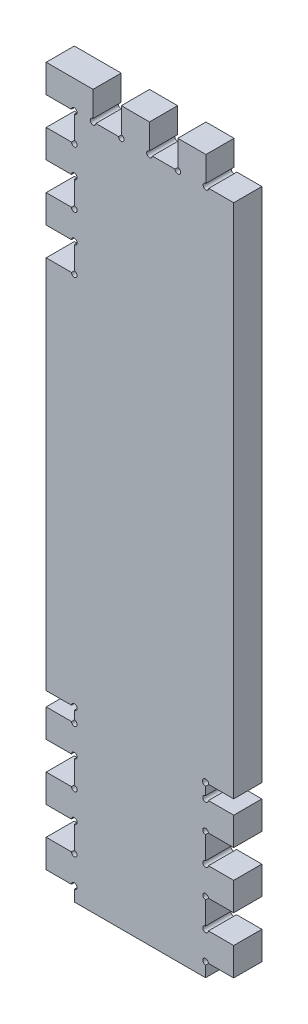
SolidWorks part; units mm, degrees
ref_plane "Ebene vorne" through (0, 0, 0) normal (0, 0, 1) x (1, 0, 0)
ref_plane "Ebene oben" through (0, 0, 0) normal (0, 1, 0) x (1, 0, 0)
ref_plane "Ebene rechts" through (0, 0, 0) normal (1, 0, 0) x (0, 0, -1)
sketch "Skizze1" plane through (0, 0, 0) normal (0, 0, 1) x (1, 0, 0)
  line L0 (0, 82.6) -> (13.5, 82.6)
  line L1 (0, 365.2705) -> (13.5, 365.2705)
  line L2 (15, 84.1) -> (15, 88.6)
  line L5 (0, 82.6) -> (0, 67.6)
  line L6 (0, 67.6) -> (13.5, 67.6)
  line L7 (15, 66.1) -> (15, 54)
  line L8 (13.5, 52.5) -> (0, 52.5)
  line L9 (0, 52.5) -> (0, 37.5)
  line L10 (0, 37.5) -> (13.5, 37.5)
  line L11 (15, 36) -> (15, 23.9)
  line L12 (85, 88.4) -> (85, 84.1)
  line L13 (0, 22.4) -> (0, 7.4)
  line L14 (13.5, 22.4) -> (0, 22.4)
  line L15 (0, 7.4) -> (13.5, 7.4)
  line L16 (86.7, 90.1) -> (100, 90.1)
  line L17 (86.5, 82.6) -> (100, 82.6)
  line L18 (100, 67.6) -> (86.5, 67.6)
  line L19 (85, 66.1) -> (85, 54)
  line L20 (86.5, 52.5) -> (100, 52.5)
  line L21 (100, 52.5) -> (100, 37.5)
  line L22 (100, 37.5) -> (86.5, 37.5)
  line L23 (85, 36) -> (85, 23.9)
  line L24 (100, 82.6) -> (100, 67.6)
  line L25 (86.5, 22.4) -> (100, 22.4)
  line L26 (100, 7.4) -> (86.5, 7.4)
  line L27 (100, 22.4) -> (100, 7.4)
  line L29 (15, 5.9) -> (15, 0)
  line L30 (85, 5.9) -> (85, 0)
  line L31 (85, 0) -> (15, 0)
  line L32 (0, 289.9705) -> (0, 90.1)
  line L33 (0, 90.1) -> (13.5, 90.1)
  line L34 (100, 90.1) -> (100, 365.4)
  line L35 (15, 291.4705) -> (15, 303.5705)
  line L36 (13.5, 350.1705) -> (0, 350.1705)
  line L37 (0, 305.0705) -> (0, 320.0705)
  line L39 (15, 321.5705) -> (15, 333.6705)
  line L40 (0, 335.1705) -> (13.5, 335.1705)
  line L41 (0, 335.1705) -> (0, 350.1705)
  line L42 (13.5, 320.0705) -> (0, 320.0705)
  line L43 (15, 351.6705) -> (15, 363.7705)
  line L44 (0, 305.0705) -> (13.5, 305.0705)
  line L45 (0, 365.2705) -> (0, 380.2705)
  line L46 (0, 380.2705) -> (25, 380.2705)
  line L47 (26.5, 365.2705) -> (38.6, 365.2705)
  line L48 (40.1, 366.7705) -> (40.1, 380.2705)
  line L49 (55.1, 380.2705) -> (54.9689, 366.7648)
  line L50 (40.1, 380.2705) -> (55.1, 380.2705)
  line L51 (56.6, 365.2705) -> (68.7, 365.2705)
  line L52 (70.2, 366.7705) -> (70.2, 380.2705)
  line L53 (85.2, 380.2705) -> (85.2, 366.9)
  line L54 (70.2, 380.2705) -> (85.2, 380.2705)
  line L55 (86.7, 365.4) -> (100, 365.4)
  line L56 (25, 366.7705) -> (25, 380.2705)
  line L57 (13.5, 289.9705) -> (0, 289.9705)
  arc A0 (13.5, 82.6) -> (15, 84.1) centre (15, 82.6) ccw
  arc A1 (13.5, 67.6) -> (15, 66.1) centre (15, 67.6) cw
  arc A2 (15, 54) -> (13.5, 52.5) centre (15, 52.5) cw
  arc A3 (13.5, 37.5) -> (15, 36) centre (15, 37.5) cw
  arc A4 (15, 23.9) -> (13.5, 22.4) centre (15, 22.4) cw
  arc A5 (13.5, 7.4) -> (15, 5.9) centre (15, 7.4) cw
  arc A6 (85, 84.1) -> (86.5, 82.6) centre (85, 82.6) ccw
  arc A7 (86.5, 67.6) -> (85, 66.1) centre (85, 67.6) ccw
  arc A8 (85, 54) -> (86.5, 52.5) centre (85, 52.5) ccw
  arc A9 (86.5, 37.5) -> (85, 36) centre (85, 37.5) ccw
  arc A10 (85, 23.9) -> (86.5, 22.4) centre (85, 22.4) ccw
  arc A11 (86.5, 7.4) -> (85, 5.9) centre (85, 7.4) ccw
  arc A12 (13.5, 289.9705) -> (15, 291.4705) centre (15, 289.9705) ccw
  arc A13 (13.5, 305.0705) -> (15, 303.5705) centre (15, 305.0705) cw
  arc A14 (13.5, 320.0705) -> (15, 321.5705) centre (15, 320.0705) ccw
  arc A15 (15, 333.6705) -> (13.5, 335.1705) centre (15, 335.1705) ccw
  arc A16 (13.5, 350.1705) -> (15, 351.6705) centre (15, 350.1705) ccw
  arc A17 (15, 363.7705) -> (13.5, 365.2705) centre (15, 365.2705) ccw
  arc A18 (25, 366.7705) -> (26.5, 365.2705) centre (25, 365.2705) ccw
  arc A19 (38.6, 365.2705) -> (40.1, 366.7705) centre (40.1, 365.2705) ccw
  arc A20 (54.9689, 366.7648) -> (56.6, 365.2705) centre (55.1, 365.2705) ccw
  arc A21 (68.7, 365.2705) -> (70.2, 366.7705) centre (70.2, 365.2705) ccw
  arc A22 (85.2, 366.9) -> (86.7, 365.4) centre (85.2, 365.4) ccw
  arc A23 (13.5, 90.1) -> (15, 88.6) centre (15, 90.1) cw
  arc A24 (86.7, 90.1) -> (85, 88.4) centre (85, 90.1) ccw
  dimension "D13" = 15
  dimension "D14" = 100
  dimension "D15" = 7.5
  dimension "D16" = 6
  dimension "D17" = 290.1705
  dimension "D18" = 14.8
  dimension "D12" = 1.5
  dimension "D19" = 1.5
  dimension "D20" = 1.5
  dimension "D21" = 1.5
  dimension "D22" = 1.5
  dimension "D23" = 1.5
  dimension "D36" = 1.5
  dimension "D37" = 1.5
  dimension "D38" = 1.5
  dimension "D39" = 1.5
  dimension "D40" = 1.5
  dimension "D41" = 1.5
  dimension "D42" = 1.5
  dimension "D43" = 1.5
  dimension "D44" = 1.5
  dimension "D45" = 1.5
  dimension "D46" = 1.5
  dimension "D3" = 15
  dimension "D5" = 15
  dimension "D6" = 15
  dimension "D7" = 15.1
  dimension "D8" = 15.1
  dimension "D9" = 15
  dimension "D10" = 15
  dimension "D11" = 15
  dimension "D24" = 15.1
  dimension "D25" = 15.1
  dimension "D28" = 15.1
  dimension "D29" = 15
  dimension "D30" = 15.1
  dimension "D31" = 15
  dimension "D32" = 15.1
  dimension "D33" = 100
  dimension "D34" = 10
  dimension "D35" = 15
  dimension "D47" = 15
  dimension "D48" = 15
  dimension "D49" = 15
  dimension "D51" = 13.5
  dimension "D52" = 15
  dimension "D53" = 12.1
  dimension "D54" = 13.5
  dimension "D55" = 12.1
  dimension "D56" = 13.5
  dimension "D57" = 15
  dimension "D58" = 15
  dimension "D59" = 5.9
  dimension "D60" = 15.1
  dimension "D61" = 15.1
  dimension "D62" = 7.4
extrude "Aufsatz-Linear austragen1" add sketch "Skizze1" along normal blind 15
